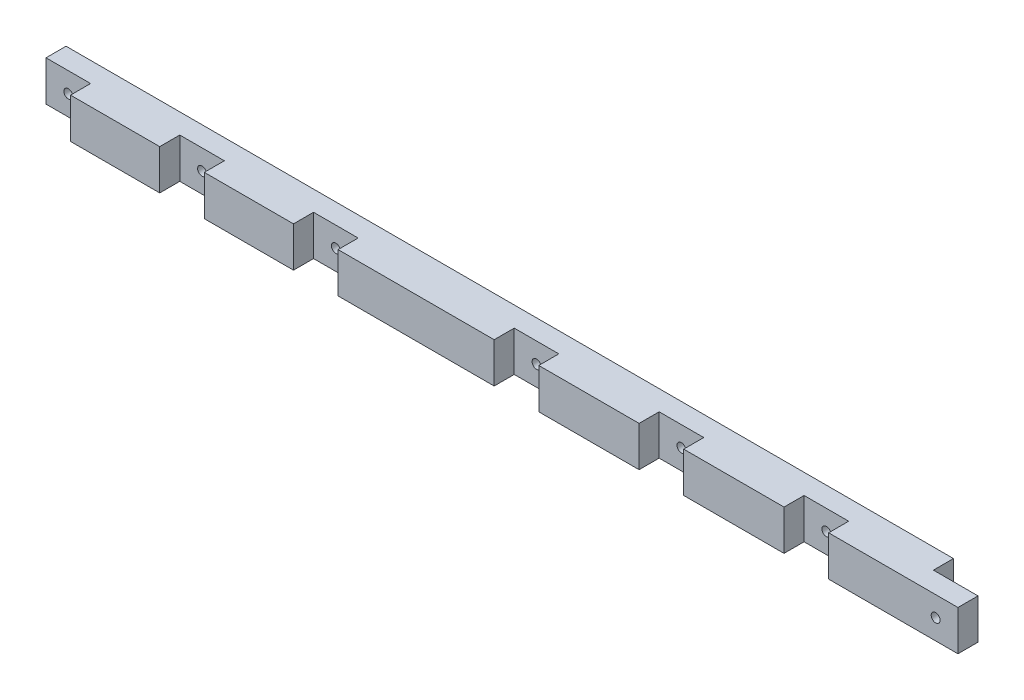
SolidWorks part; units mm, degrees
ref_plane "Plan de face" through (0, 0, 0) normal (0, 0, 1) x (1, 0, 0)
ref_plane "Plan de dessus" through (0, 0, 0) normal (0, 1, 0) x (1, 0, 0)
ref_plane "Plan de droite" through (0, 0, 0) normal (1, 0, 0) x (0, 0, -1)
sketch "Esquisse1" plane through (0, 0, 0) normal (0, 0, 1) x (1, 0, 0)
  line L1 (0, 0) -> (209, 0)
  line L2 (0, 0) -> (0, 9)
  line L3 (0, 9) -> (209, 9)
  line L4 (209, 0) -> (209, 9)
  dimension "D1" = 209
  dimension "D2" = 9
extrude "Extrusion1" add sketch "Esquisse1" along normal blind 9
sketch "Esquisse2" plane through (0, 0, 9) normal (0, 0, 1) x (1, 0, 0)
  line L0 (209, 9) -> (0, 9) construction
  line L1 (0, 0) -> (10, 0)
  line L2 (0, 0) -> (0, 9)
  line L3 (0, 9) -> (10, 9)
  line L4 (10, 0) -> (10, 9)
  dimension "D1" = 10
extrude "Enlèv. mat.-Extru.1" cut sketch "Esquisse2" against normal blind 4.5
sketch "Esquisse3" plane through (0, 0, 4.5) normal (0, 0, 1) x (1, 0, 0)
  line L0 (0, 9) -> (0, 0) construction
  line L1 (10, 9) -> (0, 9) construction
  circle A0 centre (5, 4.5) radius 1
  point P2 (0, 4.5)
  point P5 (5, 9)
  dimension "D3" = 2
  dimension "D1" = 5
  dimension "D2" = 4.5
extrude "Enlèv. mat.-Extru.2" cut sketch "Esquisse3" against normal blind 4.5
sketch "Esquisse4" plane through (0, 0, 9) normal (0, 0, 1) x (1, 0, 0)
  line L0 (10, 0) -> (209, 0) construction
  line L1 (30, 0) -> (40, 0)
  line L2 (30, 0) -> (30, 9)
  line L3 (30, 9) -> (40, 9)
  line L4 (40, 0) -> (40, 9)
  line L5 (209, 9) -> (10, 9) construction
  dimension "D1" = 10
  dimension "D2" = 20
extrude "Enlèv. mat.-Extru.4" cut sketch "Esquisse4" against normal blind 4.5
sketch "Esquisse6" plane through (0, 0, 4.5) normal (0, 0, 1) x (1, 0, 0)
  line L0 (30, 9) -> (30, 0) construction
  line L1 (30, 0) -> (40, 0) construction
  circle A0 centre (35, 4.5) radius 1
  point P4 (35, 0)
  dimension "D3" = 2
  dimension "D1" = 5
  dimension "D2" = 4.5
extrude "Enlèv. mat.-Extru.5" cut sketch "Esquisse6" against normal blind 4.5
sketch "Esquisse7" plane through (0, 0, 9) normal (0, 0, 1) x (1, 0, 0)
  line L0 (40, 0) -> (209, 0) construction
  line L1 (60, 0) -> (70, 0)
  line L2 (60, 0) -> (60, 9)
  line L3 (60, 9) -> (70, 9)
  line L4 (70, 0) -> (70, 9)
  line L5 (209, 9) -> (40, 9) construction
  dimension "D1" = 10
  dimension "D2" = 20
extrude "Enlèv. mat.-Extru.6" cut sketch "Esquisse7" against normal blind 4.5
sketch "Esquisse8" plane through (0, 0, 4.5) normal (0, 0, 1) x (1, 0, 0)
  line L0 (60, 9) -> (60, 0) construction
  line L1 (70, 9) -> (60, 9) construction
  circle A0 centre (65, 4.5) radius 1
  point P2 (60, 4.5)
  point P5 (65, 9)
  dimension "D3" = 2
  dimension "D1" = 5
  dimension "D2" = 4.5
extrude "Enlèv. mat.-Extru.7" cut sketch "Esquisse8" against normal blind 4.5
sketch "Esquisse9" plane through (0, 0, 9) normal (0, 0, 1) x (1, 0, 0)
  line L0 (70, 0) -> (209, 0) construction
  line L1 (105, 0) -> (115, 0)
  line L2 (105, 0) -> (105, 9)
  line L3 (105, 9) -> (115, 9)
  line L4 (115, 0) -> (115, 9)
  line L5 (209, 9) -> (70, 9) construction
  dimension "D1" = 10
  dimension "D2" = 35
extrude "Enlèv. mat.-Extru.8" cut sketch "Esquisse9" against normal blind 4.5
sketch "Esquisse10" plane through (0, 0, 4.5) normal (0, 0, 1) x (1, 0, 0)
  line L0 (105, 9) -> (105, 0) construction
  line L1 (105, 0) -> (115, 0) construction
  circle A0 centre (110, 4.5) radius 1
  point P2 (105, 4.5)
  point P5 (110, 0)
  dimension "D3" = 2
  dimension "D1" = 5
  dimension "D2" = 4.5
extrude "Enlèv. mat.-Extru.9" cut sketch "Esquisse10" against normal blind 4.5
sketch "Esquisse11" plane through (0, 0, 9) normal (0, 0, 1) x (1, 0, 0)
  line L0 (115, 0) -> (209, 0) construction
  line L1 (137.5, 0) -> (147.5, 0)
  line L2 (137.5, 0) -> (137.5, 9)
  line L3 (137.5, 9) -> (147.5, 9)
  line L4 (147.5, 0) -> (147.5, 9)
  line L5 (209, 9) -> (115, 9) construction
  dimension "D1" = 10
  dimension "D2" = 22.5
extrude "Enlèv. mat.-Extru.10" cut sketch "Esquisse11" against normal blind 4.5
sketch "Esquisse12" plane through (0, 0, 4.5) normal (0, 0, 1) x (1, 0, 0)
  line L0 (137.5, 9) -> (137.5, 0) construction
  line L1 (137.5, 0) -> (147.5, 0) construction
  circle A0 centre (142.5, 4.5) radius 1
  dimension "D3" = 2
  dimension "D1" = 5
  dimension "D2" = 4.5
extrude "Enlèv. mat.-Extru.11" cut sketch "Esquisse12" against normal blind 4.5
sketch "Esquisse13" plane through (0, 0, 9) normal (0, 0, 1) x (1, 0, 0)
  line L0 (147.5, 0) -> (209, 0) construction
  line L1 (170, 0) -> (180, 0)
  line L2 (170, 0) -> (170, 9)
  line L3 (170, 9) -> (180, 9)
  line L4 (180, 0) -> (180, 9)
  line L5 (209, 9) -> (147.5, 9) construction
  dimension "D1" = 10
  dimension "D2" = 22.5
extrude "Enlèv. mat.-Extru.12" cut sketch "Esquisse13" against normal blind 4.5
sketch "Esquisse14" plane through (0, 0, 4.5) normal (0, 0, 1) x (1, 0, 0)
  line L0 (170, 9) -> (170, 0) construction
  line L1 (180, 9) -> (170, 9) construction
  circle A0 centre (175, 4.5) radius 1
  dimension "D3" = 2
  dimension "D1" = 5
  dimension "D2" = 4.5
extrude "Enlèv. mat.-Extru.13" cut sketch "Esquisse14" against normal blind 4.5
sketch "Esquisse15" plane through (0, 0, 0) normal (0, 0, -1) x (-1, 0, 0)
  line L0 (0, 0) -> (-209, 0) construction
  line L1 (-209, 9) -> (-199, 9)
  line L2 (-209, 9) -> (-209, 0)
  line L3 (-209, 0) -> (-199, 0)
  line L4 (-199, 9) -> (-199, 0)
  dimension "D1" = 10
extrude "Enlèv. mat.-Extru.14" cut sketch "Esquisse15" against normal blind 4.5
sketch "Esquisse16" plane through (0, 0, 4.5) normal (0, 0, -1) x (-1, 0, 0)
  line L0 (-209, 9) -> (-209, 0) construction
  line L1 (-209, 0) -> (-199, 0) construction
  circle A0 centre (-204, 4.5) radius 1
  point P2 (0, 0)
  dimension "D3" = 2
  dimension "D1" = 5
  dimension "D2" = 4.5
extrude "Enlèv. mat.-Extru.15" cut sketch "Esquisse16" against normal blind 4.5
